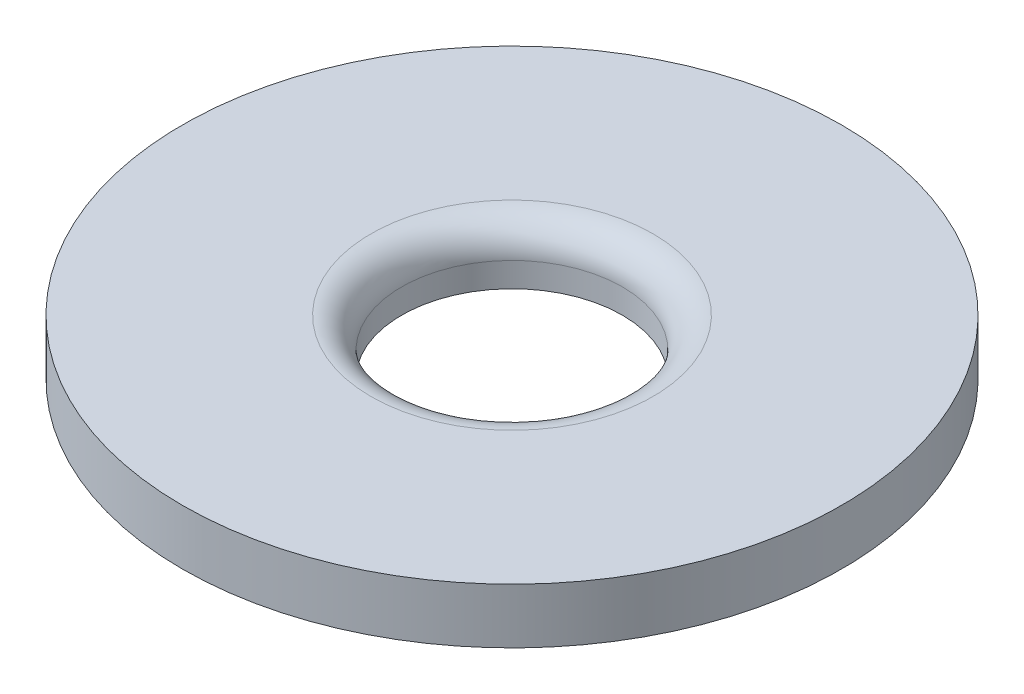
SolidWorks part; units mm, degrees
ref_plane "Plan de face" through (0, 0, 0) normal (0, 0, 1) x (1, 0, 0)
ref_plane "Plan de dessus" through (0, 0, 0) normal (0, 1, 0) x (1, 0, 0)
ref_plane "Plan de droite" through (0, 0, 0) normal (1, 0, 0) x (0, 0, -1)
sketch "Esquisse1" plane through (0, 0, 0) normal (0, 0, 1) x (1, 0, 0)
  line L0 (0, 0) -> (0, 23.021) construction
  line L2 (3.6, -0.3) -> (10.75, -0.3)
  line L3 (3.6, -0.3) -> (3.6, 0.5)
  line L4 (4.6, 1.5) -> (10.75, 1.5)
  line L5 (10.75, -0.3) -> (10.75, 1.5)
  arc A0 (3.6, 0.5) -> (4.6, 1.5) centre (4.6, 0.5) cw
  dimension "D4" = 1
  dimension "D1" = 1.8
  dimension "D2" = 7.2
  dimension "D3" = 21.5
  dimension "D5" = 1.5
revolve "Révolution1" add sketch "Esquisse1" angle 360 about L0
